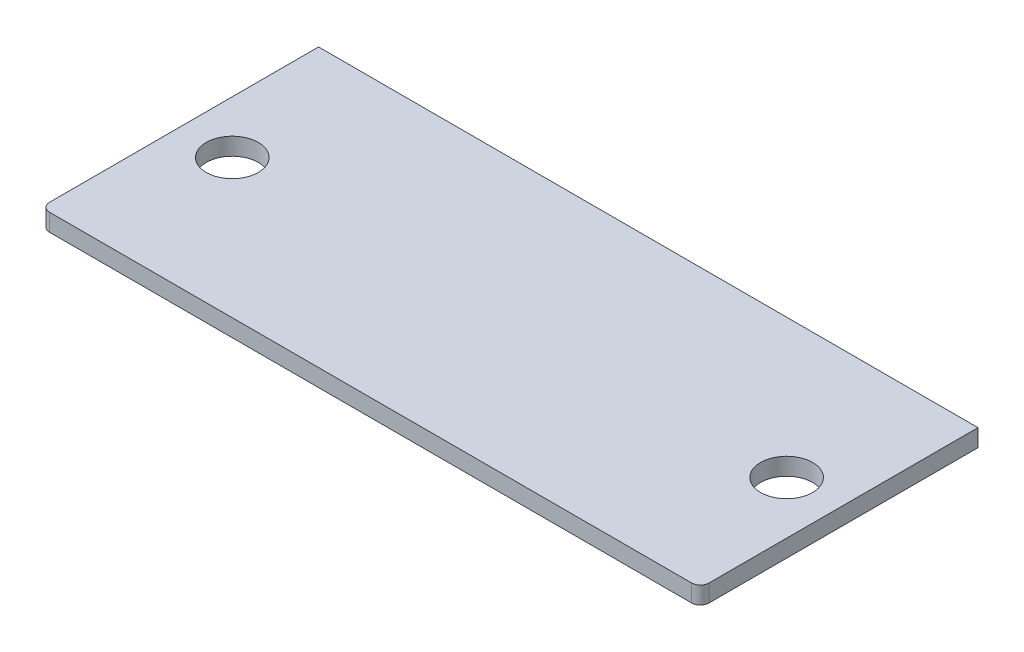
SolidWorks part; units mm, degrees
ref_plane "Plan de face" through (0, 0, 0) normal (0, 0, 1) x (1, 0, 0)
ref_plane "Plan de dessus" through (0, 0, 0) normal (0, 1, 0) x (1, 0, 0)
ref_plane "Plan de droite" through (0, 0, 0) normal (1, 0, 0) x (0, 0, -1)
sketch "Esquisse1" plane through (0, 0, 0) normal (0, 1, 0) x (1, 0, 0)
  line L0 (38, 8) -> (0, 8) construction
  line L1 (0, 0) -> (38, 0)
  line L2 (0, 0) -> (0, 16)
  line L3 (0, 16) -> (38, 16)
  line L4 (38, 0) -> (38, 16)
  line L5 (19, 16) -> (19, 0) construction
  circle A0 centre (34.9716, 8) radius 1.5
  circle A1 centre (3.0284, 8) radius 1.5
  dimension "D1" = 38
  dimension "D2" = 16
extrude "Extrusion1" add sketch "Esquisse1" along normal blind 1
fillet "Congé1" radius 0.5 2 edges at (38, 0.5, 0) (0, 0.5, 0)
